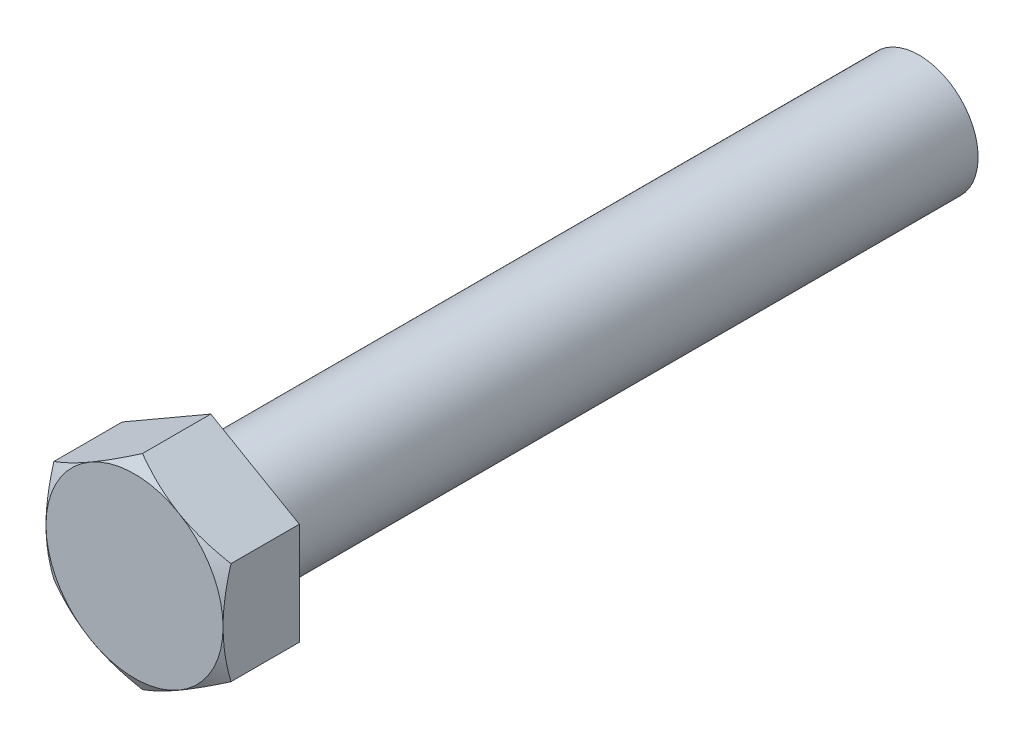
SolidWorks part; units mm, degrees
ref_plane "FRONT" through (0, 0, 0) normal (0, 0, 1) x (1, 0, 0)
ref_plane "TOP" through (0, 0, 0) normal (0, 1, 0) x (1, 0, 0)
ref_plane "SIDE" through (0, 0, 0) normal (1, 0, 0) x (0, 0, -1)
sketch "Sketch1" plane through (0, 0, 0) normal (0, 0, 1) x (1, 0, 0)
  circle A0 centre (0, 0) radius 6.35
  dimension "ThreadDia" = 12.7
extrude "THREADS" add sketch "Sketch1" along normal blind 76.2
sketch "Sketch2" plane through (0, 0, 76.2) normal (0, 0, 1) x (1, 0, 0)
  line L0 (0, 10.2381) -> (0, -11.8583) construction
  line L1 (0, 10.9985) -> (9.525, 5.4993)
  line L2 (9.525, 5.4993) -> (9.525, -5.4993)
  line L3 (9.525, -5.4993) -> (0, -10.9985)
  line L4 (-9.525, -5.4993) -> (0, -10.9985)
  line L5 (-9.525, 5.4993) -> (-9.525, -5.4993)
  line L6 (0, 10.9985) -> (-9.525, 5.4993)
  circle A0 centre (0, 0) radius 9.525 construction
  dimension "HEAD WIDTH" = 19.05
extrude "HEX HEAD" add sketch "Sketch2" along normal blind 8.2042
sketch "Sketch3" plane through (0, 0, 84.4042) normal (0, 0, 1) x (1, 0, 0)
  line L0 (0, 10.9985) -> (-9.525, 5.4993) construction
  circle A0 centre (0, 0) radius 9.525
extrude "Chamfer" cut sketch "Sketch3" against normal through all draft 60 flip side to cut
